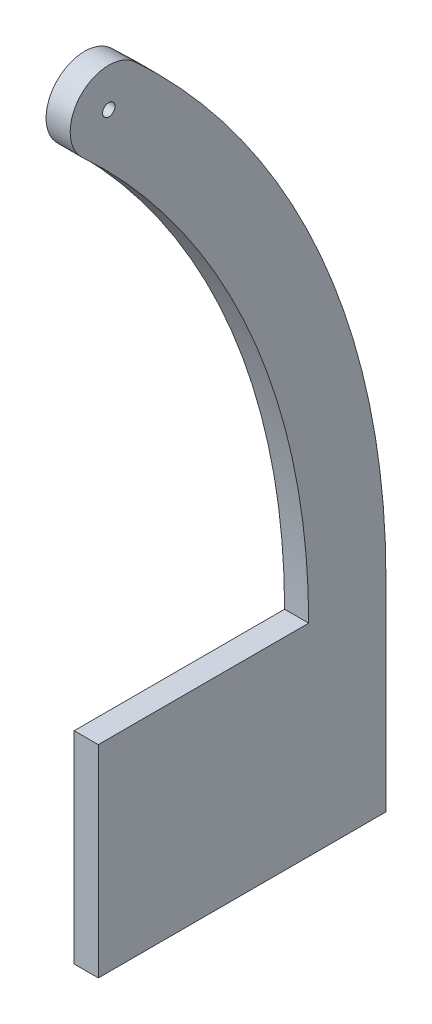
SolidWorks part; units mm, degrees
ref_plane "Front Plane" through (0, 0, 0) normal (0, 0, 1) x (1, 0, 0)
ref_plane "Top Plane" through (0, 0, 0) normal (0, 1, 0) x (1, 0, 0)
ref_plane "Right Plane" through (0, 0, 0) normal (1, 0, 0) x (0, 0, -1)
sketch "Sketch1" plane through (0, 0, 0) normal (1, 0, 0) x (0, 0, -1)
  line L0 (0, 52) -> (0, 0)
  line L1 (0, 0) -> (-74, 0)
  line L2 (-74, 0) -> (-74, 52)
  line L3 (-74, 52) -> (-19.8682, 52)
  arc A0 (-19.8682, 52) -> (-78.0346, 184.8024) centre (-200.5551, 52) ccw
  arc A1 (-78.0346, 184.8024) -> (-64.5623, 199.4053) centre (-71.2985, 192.1039) cw
  arc A2 (-64.5623, 199.4053) -> (0, 52) centre (-200.5551, 52) cw
  circle A3 centre (-71.2985, 192.1039) radius 1.6
  dimension "D5" = 3.2
  dimension "D6" = 9.9341
  dimension "D1" = 52
  dimension "D2" = 74
  dimension "D3" = 54.1318
  dimension "D4" = 52
extrude "Boss-Extrude1" add sketch "Sketch1" along normal blind 6.2
